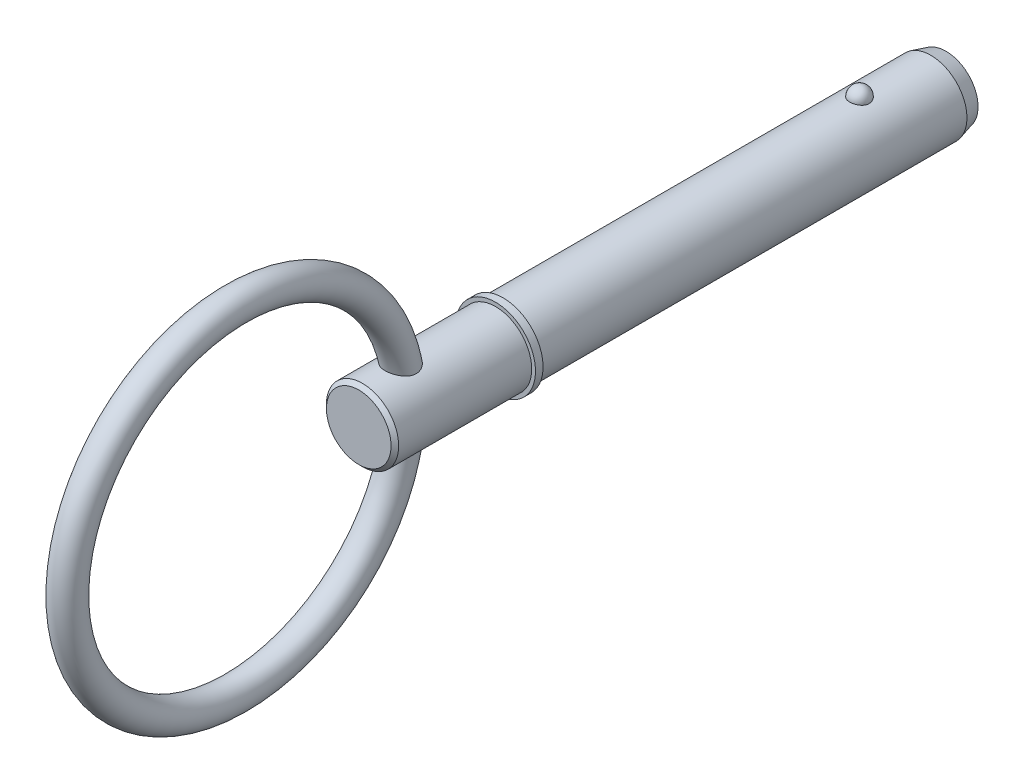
SolidWorks part; units mm, degrees
ref_plane "Front Plane" through (0, 0, 0) normal (0, 0, 1) x (1, 0, 0)
ref_plane "Top Plane" through (0, 0, 0) normal (0, 1, 0) x (1, 0, 0)
ref_plane "Right Plane" through (0, 0, 0) normal (1, 0, 0) x (0, 0, -1)
sketch "Sketch2" plane through (0, 0, 0) normal (0, 0, 1) x (1, 0, 0)
  circle A0 centre (0, 0) radius 4.765
  point P3 (0, 4.765)
  dimension "D1" = 9.53
extrude "Boss-Extrude1" add sketch "Sketch2" along normal blind 45.72
sketch "Sketch3" plane through (0, 0, 0) normal (0, 0, -1) x (-1, 0, 0)
  circle A0 centre (0, 0) radius 4.765
  dimension "D1" = 9.53
extrude "Boss-Extrude2" add sketch "Sketch3" along normal blind 12.7
chamfer "Chamfer1" distance 2 angle 15 1 edges at (-4.765, 0, -12.7)
sketch "Sketch18" plane through (0, 0, 0) normal (1, 0, 0) x (0, 0, -1)
  line L0 (10.7, 4.765) -> (-45.72, 4.765) construction
  line L1 (1.29, 6.055) -> (1.29, 3.475)
  line L2 (-45.72, -4.765) -> (10.7, -4.765) construction
  arc A0 (1.29, 6.055) -> (1.29, 3.475) centre (1.29, 4.765) ccw
  point P4 (0, 4.765)
  dimension "D1" = 10.82
revolve "Revolve1" add sketch "Sketch18" angle 360 about L1
sketch "Sketch19" plane through (0, 0, 0) normal (1, 0, 0) x (0, 0, -1)
  line L0 (-33.7288, 0) -> (-46.4542, 0) construction
sketch "Sketch20" plane through (0, 0, 0) normal (1, 0, 0) x (0, 0, -1)
  line L0 (-45.72, 0) -> (-45.72, 5.265)
  line L1 (-45.72, 4.765) -> (-45.72, -4.765) construction
  line L2 (-45.72, 5.265) -> (-46.72, 5.265)
  line L3 (-46.72, 5.265) -> (-46.72, 0)
  line L4 (-33.7288, 0) -> (-46.4542, 0) construction
  line L5 (-46.72, 0) -> (-45.72, 0)
  dimension "D1" = 5.265
  dimension "D2" = 1
revolve "Revolve2" add sketch "Sketch20" angle 360 about L0
sketch "Sketch21" plane through (0, 0, 45.72) normal (0, 0, -1) x (-1, 0, 0)
  circle A0 centre (0, 0) radius 4.765
  dimension "D1" = 9.53
extrude "Boss-Extrude3" add sketch "Sketch21" against normal blind 19.05
chamfer "Chamfer2" distance 0.5 angle 45 1 edges at (-4.765, 0, 64.77)
sketch "Sketch23" plane through (0, 0, 0) normal (1, 0, 0) x (0, 0, -1)
  line L0 (-64.77, 4.265) -> (-64.77, -4.265) construction
  circle A0 centre (-80.995, 0) radius 22.225
  point P2 (-58.77, 0)
  dimension "D1" = 44.45
  dimension "D2" = 6
sketch "Sketch24" plane through (0, 0, 0) normal (0, 1, 0) x (1, 0, 0)
  circle A0 centre (0, -58.77) radius 2
  dimension "D1" = 4
sweep "Sweep1" add profiles "Sketch24" path "Sketch23"
